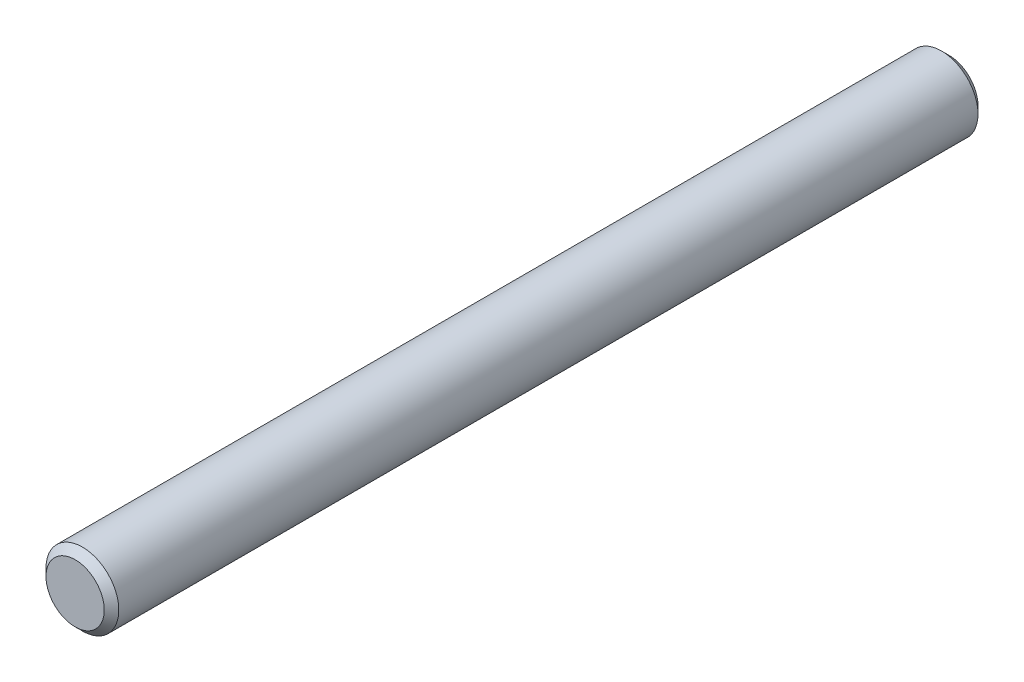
SolidWorks part; units mm, degrees
ref_plane "Front" through (0, 0, 0) normal (0, 0, 1) x (1, 0, 0)
ref_plane "Top" through (0, 0, 0) normal (0, 1, 0) x (1, 0, 0)
ref_plane "Right" through (0, 0, 0) normal (1, 0, 0) x (0, 0, -1)
sketch "Sketch1" plane through (0, 0, 0) normal (0, 0, 1) x (1, 0, 0)
  circle A0 centre (0, 0) radius 3.175
  dimension "dia" = 6.35
extrude "Extrude1" add sketch "Sketch1" along normal mid plane 76.2
sketch "Sketch2" plane through (0, 0, 0) normal (1, 0, 0) x (0, 0, -1)
  point P0 (-38.1, 3.175)
  point P1 (38.1, 3.175)
chamfer "Chamfer1" distance 0.635 angle 45 2 edges at (3.175, 0, -38.1) (3.175, 0, 38.1)
equation "\"D1@Chamfer1\" = \"dia@Sketch1\" * .1"
